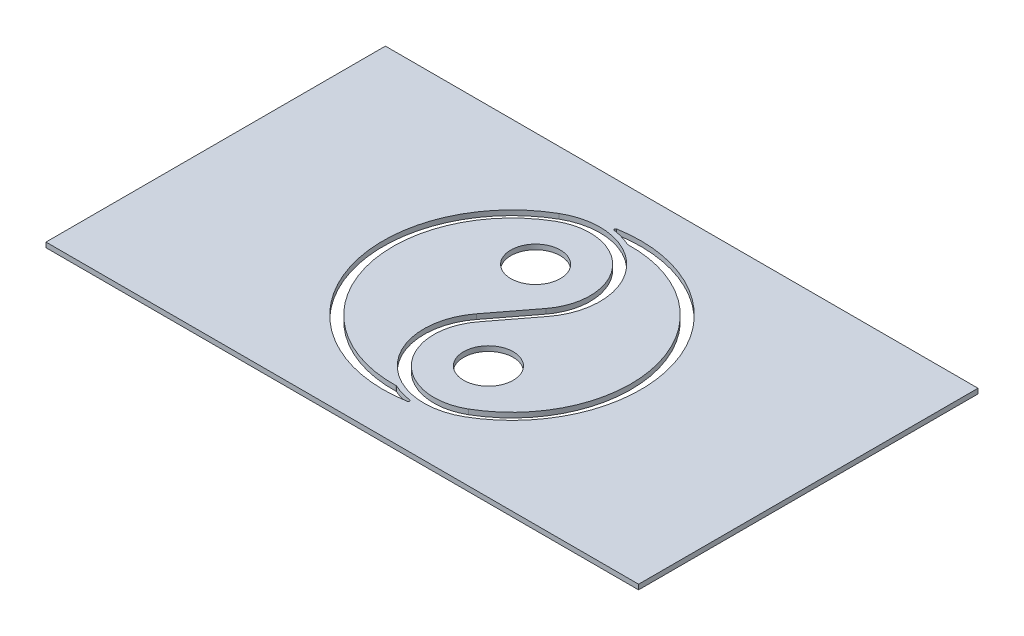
SolidWorks part; units mm, degrees
ref_plane "Vorne" through (0, 0, 0) normal (0, 0, 1) x (1, 0, 0)
ref_plane "Oben" through (0, 0, 0) normal (0, 1, 0) x (1, 0, 0)
ref_plane "Rechts" through (0, 0, 0) normal (1, 0, 0) x (0, 0, -1)
sketch "Skizze1" plane through (0, 0, 0) normal (0, 1, 0) x (1, 0, 0)
  line L1 (0, 0) -> (119.5142, 0)
  line L2 (0, 0) -> (0, 68.4506)
  line L3 (0, 68.4506) -> (119.5142, 68.4506)
  line L4 (119.5142, 0) -> (119.5142, 68.4506)
extrude "Linear austragen1" add sketch "Skizze1" along normal blind 1
sketch "Skizze2" plane through (0, 1, 0) normal (0, 1, 0) x (-1, 0, 0)
  line L0 (-66.2571, -22.967) -> (-53.2571, -45.4836) construction
  line L1 (0, 0) -> (-119.5142, -68.4506) construction
  line L2 (-119.5142, 0) -> (-119.5142, -68.4506) construction
  line L3 (-56.7216, -30.2522) -> (-62.7926, -38.1984) construction
  line L4 (-57.5162, -29.6451) -> (-63.5872, -37.5913)
  line L5 (-55.927, -30.8593) -> (-61.998, -38.8055)
  circle A0 centre (-59.7571, -34.2253) radius 25 construction
  arc A1 (-56.7216, -30.2522) -> (-72.2571, -12.5747) centre (-66.2571, -22.967) ccw construction
  circle A2 centre (-66.2571, -22.967) radius 5
  circle A3 centre (-53.2571, -45.4836) radius 5
  arc A4 (-62.7926, -38.1984) -> (-47.2571, -55.8759) centre (-53.2571, -45.4836) ccw construction
  arc A5 (-57.5162, -29.6451) -> (-71.7571, -13.4407) centre (-66.2571, -22.967) ccw
  arc A6 (-63.5872, -37.5913) -> (-46.7571, -56.742) centre (-53.2571, -45.4836) ccw
  arc A7 (-55.927, -30.8593) -> (-72.7571, -11.7086) centre (-66.2571, -22.967) ccw
  arc A8 (-61.998, -38.8055) -> (-47.7571, -55.0099) centre (-53.2571, -45.4836) ccw
  arc A9 (-46.7571, -56.742) -> (-65.9378, -8.9706) centre (-59.7571, -34.2253) ccw
  arc A10 (-47.7571, -55.0099) -> (-60.4353, -10.2349) centre (-59.7571, -34.2253) ccw
  arc A11 (-59.079, -58.2157) -> (-53.5764, -59.48) centre (-53.2571, -45.4836) ccw
  arc A12 (-60.4353, -10.2349) -> (-65.9378, -8.9706) centre (-66.2571, -22.967) ccw
  arc A13 (-64.3819, -36.9842) -> (-46.2571, -57.608) centre (-53.2571, -45.4836) ccw construction
  circle A14 centre (-59.7571, -34.2253) radius 26 construction
  circle A15 centre (-59.7571, -34.2253) radius 24 construction
  arc A16 (-55.1324, -31.4664) -> (-73.2571, -10.8426) centre (-66.2571, -22.967) ccw construction
  arc A17 (-71.7571, -13.4407) -> (-59.079, -58.2157) centre (-59.7571, -34.2253) ccw
  arc A18 (-72.7571, -11.7086) -> (-53.5764, -59.48) centre (-59.7571, -34.2253) ccw
  dimension "D1" = 50
  dimension "D2" = 30
  dimension "D3" = 10
  dimension "D4" = 24
  dimension "D5" = 1
  dimension "D9" = 1
extrude "Schnitt-Linear austragen1" cut sketch "Skizze2" against normal through all
fillet "Verrundung1" radius 0.25 4 edges at (60.4353, 0.5, -10.2349) (65.9378, 0.5, -8.9706) (53.5764, 0.5, -59.48) (59.079, 0.5, -58.2157)
